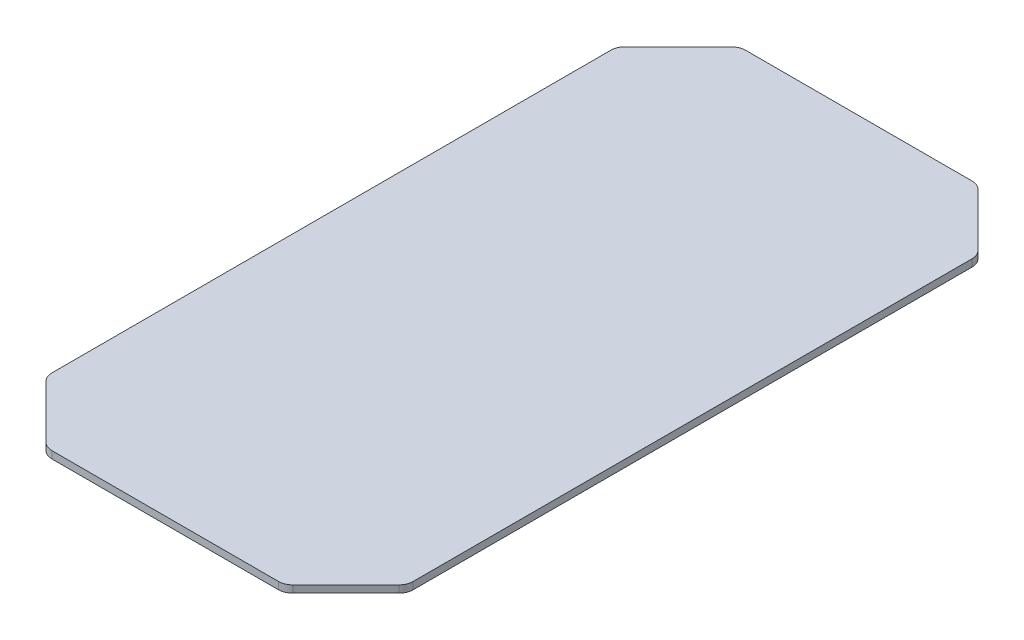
SolidWorks part; units mm, degrees
ref_plane "Front Plane" through (0, 0, 0) normal (0, 0, 1) x (1, 0, 0)
ref_plane "Top Plane" through (0, 0, 0) normal (0, 1, 0) x (1, 0, 0)
ref_plane "Right Plane" through (0, 0, 0) normal (1, 0, 0) x (0, 0, -1)
sketch "Sketch1" plane through (0, 0, 0) normal (0, 1, 0) x (1, 0, 0)
  line L1 (-158.75, -304.8) -> (158.75, -304.8)
  line L2 (-158.75, -304.8) -> (-158.75, 304.8)
  line L3 (-158.75, 304.8) -> (158.75, 304.8)
  line L4 (158.75, -304.8) -> (158.75, 304.8)
  line L5 (-158.75, -304.8) -> (158.75, 304.8) construction
  line L6 (-158.75, 304.8) -> (158.75, -304.8) construction
  point P0 (0, 0)
  dimension "D1" = 317.5
  dimension "D2" = 609.6
extrude "Boss-Extrude1" add sketch "Sketch1" along normal blind 6.35
chamfer "Chamfer1" distance 53.975 angle 45 4 edges at (158.75, 3.175, 304.8) (158.75, 3.175, -304.8) (-158.75, 3.175, -304.8) (-158.75, 3.175, 304.8)
fillet "Fillet1" radius 12.7 8 edges at (158.75, 3.175, -250.825) (104.775, 3.175, -304.8) (-104.775, 3.175, -304.8) (-158.75, 3.175, -250.825) (158.75, 3.175, 250.825) (104.775, 3.175, 304.8) (-104.775, 3.175, 304.8) (-158.75, 3.175, 250.825)
equation "\"D1@Sketch1\" = \"D6@Desk Control Sketch@CF Desk Tube Frame-1.Part\"+.5"
equation "\"D2@Sketch1\" = \"D3@Desk Control Sketch@CF Desk Tube Frame-1.Part\""
